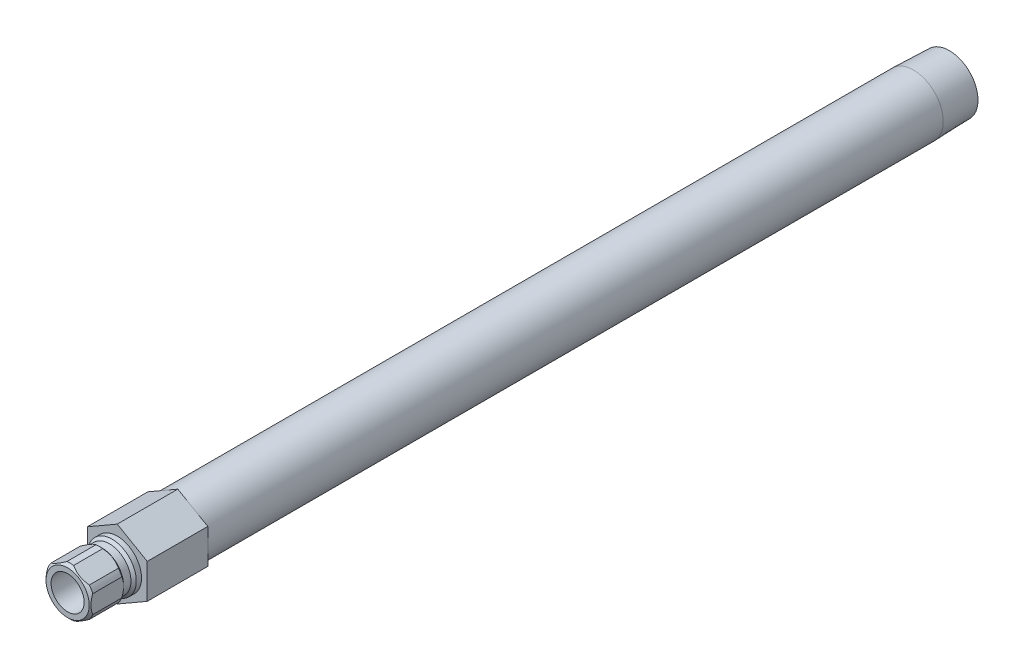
SolidWorks part; units mm, degrees
ref_plane "Front Plane" through (0, 0, 0) normal (0, 0, 1) x (1, 0, 0)
ref_plane "Top Plane" through (0, 0, 0) normal (0, 1, 0) x (1, 0, 0)
ref_plane "Right Plane" through (0, 0, 0) normal (1, 0, 0) x (0, 0, -1)
sketch "Sketch1" plane through (0, 0, 0) normal (1, 0, 0) x (0, 0, -1)
  line L0 (0, 0) -> (-17.4752, 0) construction
  line L1 (-14.3002, 4.7625) -> (-14.3002, 6.223)
  line L2 (-4.3942, 6.223) -> (-4.3942, 0) construction
  line L3 (-13.5382, 6.985) -> (-5.1562, 6.985)
  line L5 (-4.3942, 6.223) -> (-2.2708, 6.223)
  line L6 (-1.5088, 6.985) -> (3.175, 6.985)
  line L7 (3.175, 6.985) -> (3.175, 8.5725)
  line L8 (-4.3942, 6.223) -> (-5.1562, 6.985)
  line L9 (-2.2708, 6.223) -> (-1.5088, 6.985)
  line L10 (-14.3002, 6.223) -> (-13.5382, 6.985)
  line L11 (-14.3002, 4.7625) -> (17.4498, 4.7625)
  line L12 (3.175, 8.5725) -> (229.362, 8.5725)
  line L13 (229.362, 8.5725) -> (239.6998, 8.2494)
  line L14 (239.6998, 8.2494) -> (239.6998, 6.2611)
  line L15 (0, 8.5725) -> (0, 0) construction
  line L16 (17.4498, 4.7625) -> (17.4498, 0) construction
  line L17 (17.4498, 0) -> (0, 0) construction
  line L18 (17.4498, 4.7625) -> (17.4498, 6.2611)
  line L19 (17.4498, 6.2611) -> (239.6998, 6.2611)
  dimension "D1" = 17.4752
  dimension "D2" = 2.1234
  dimension "D3" = 0.762
  dimension "D4" = 45
  dimension "D5" = 9.906
  dimension "D6" = 45
  dimension "D7" = 1.79
  dimension "D8" = 10.3378
  dimension "D9" = 254
  dimension "D10" = 3.175
  dimension "D11" = 9.525
  dimension "D12" = 17.145
  dimension "D13" = 31.75
  dimension "D14" = 13.97
  dimension "D15" = 12.5222
  dimension "D16" = 17.4498
revolve "Revolve1" add sketch "Sketch1" angle 360 about L0
sketch "Sketch2" plane through (0, 0, 0) normal (0, 0, 1) x (1, 0, 0)
  line L1 (-8.636, 4.986) -> (-8.636, -4.986)
  line L2 (-8.636, -4.986) -> (0, -9.972)
  line L3 (0, -9.972) -> (8.636, -4.986)
  line L4 (8.636, -4.986) -> (8.636, 4.986)
  line L5 (8.636, 4.986) -> (0, 9.972)
  line L6 (0, 9.972) -> (-8.636, 4.986)
  circle A0 centre (0, 0) radius 8.636 construction
  circle A1 centre (0, 0) radius 4.7625 construction
  circle A2 centre (0, 0) radius 4.7625
  dimension "D1" = 17.272
extrude "Boss-Extrude1" add sketch "Sketch2" against normal up to vertex (17.4498 mm away)
sketch "Sketch3" plane through (0, 0, 0) normal (0, 0, 1) x (1, 0, 0)
  line L1 (6.477, -3.7395) -> (6.477, 3.7395)
  line L2 (6.477, 3.7395) -> (0, 7.479)
  line L3 (0, 7.479) -> (-6.477, 3.7395)
  line L4 (-6.477, 3.7395) -> (-6.477, -3.7395)
  line L5 (-6.477, -3.7395) -> (0, -7.479)
  line L6 (0, -7.479) -> (6.477, -3.7395)
  circle A0 centre (0, 0) radius 6.477 construction
  dimension "D1" = 12.954
extrude "Cut-Extrude1" cut sketch "Sketch3" along normal through all from vertex at 4.3942 flip side to cut
